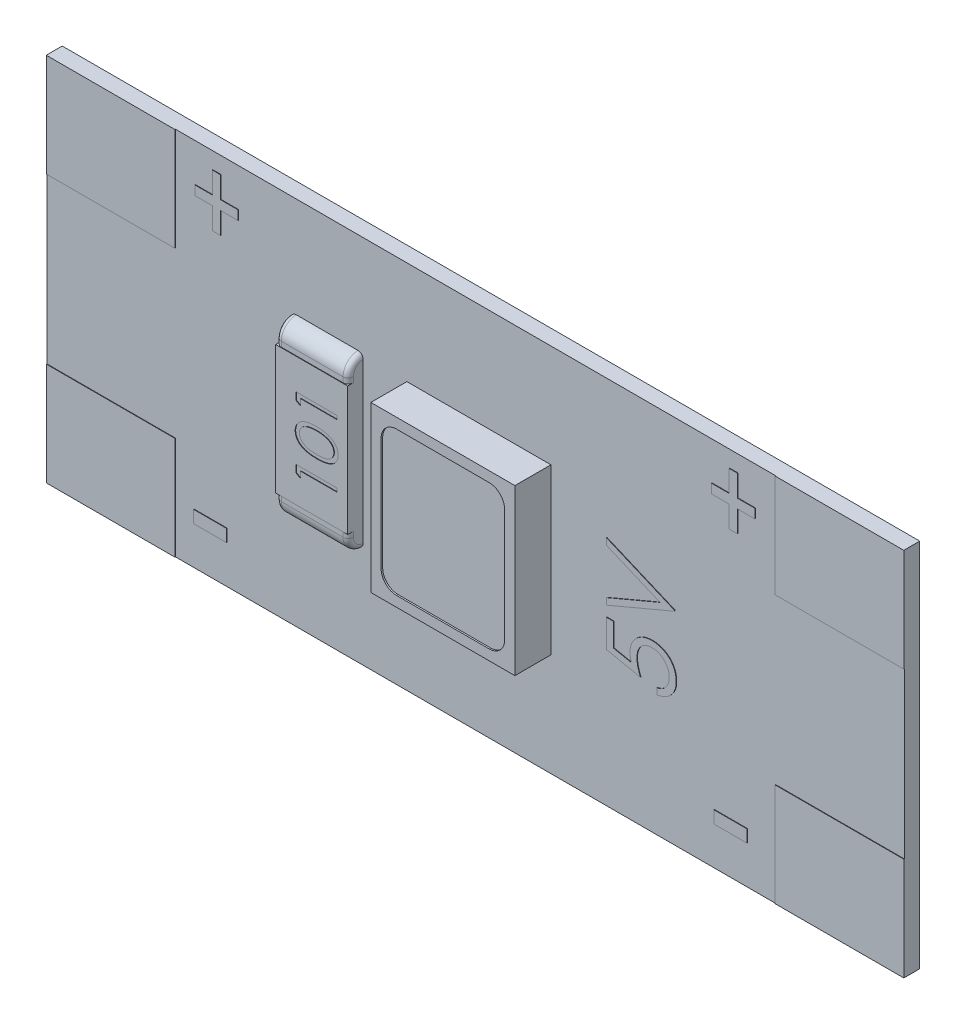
SolidWorks part; units mm, degrees
ref_plane "Front Plane" through (0, 0, 0) normal (0, 0, 1) x (1, 0, 0)
ref_plane "Top Plane" through (0, 0, 0) normal (0, 1, 0) x (1, 0, 0)
ref_plane "Right Plane" through (0, 0, 0) normal (1, 0, 0) x (0, 0, -1)
sketch "Skizze1" plane through (0, 0, 0) normal (0, 0, 1) x (1, 0, 0)
  line L1 (-8.33, 3.6) -> (8.34, 3.6)
  line L2 (-8.33, 3.6) -> (-8.33, -3.6)
  line L3 (-8.33, -3.6) -> (8.34, -3.6)
  line L4 (8.34, 3.6) -> (8.34, -3.6)
  dimension "D1" = 7.2
  dimension "D2" = 16.67
  dimension "D3" = 8.33
  dimension "D4" = 3.6
extrude "Aufsatz-Linear austragen1" add sketch "Skizze1" along normal blind 0.3
sketch "Skizze2" plane through (0, 0, 0.3) normal (0, 0, 1) x (1, 0, 0)
  line L0 (-8.33, 3.6) -> (-8.33, -3.6) construction
  line L1 (-8.33, 3.6) -> (-5.83, 3.6)
  line L2 (-8.33, 3.6) -> (-8.33, 1.6)
  line L3 (-8.33, 1.6) -> (-5.83, 1.6)
  line L4 (-5.83, 3.6) -> (-5.83, 1.6)
  line L5 (8.34, -3.6) -> (8.34, 3.6) construction
  line L6 (-8.33, -1.6) -> (-5.83, -1.6)
  line L7 (-8.33, -1.6) -> (-8.33, -3.6)
  line L8 (-8.33, -3.6) -> (-5.83, -3.6)
  line L9 (-5.83, -1.6) -> (-5.83, -3.6)
  line L10 (8.34, 3.6) -> (5.84, 3.6)
  line L11 (8.34, 3.6) -> (8.34, 1.6)
  line L12 (8.34, 1.6) -> (5.84, 1.6)
  line L13 (5.84, 3.6) -> (5.84, 1.6)
  line L15 (8.34, -1.6) -> (5.84, -1.6)
  line L16 (8.34, -1.6) -> (8.34, -3.6)
  line L17 (8.34, -3.6) -> (5.84, -3.6)
  line L18 (5.84, -1.6) -> (5.84, -3.6)
  point P20 (-8.33, 3.6)
  point P21 (-8.33, -3.6)
  point P22 (8.34, 3.6)
  point P26 (8.34, -3.6)
  point P28 (-7.08, 1.6)
  point P29 (-7.08, -3.6)
  point P30 (5.84, -2.6)
  dimension "D1" = 2
  dimension "D2" = 2
  dimension "D3" = 2
  dimension "D4" = 2
  dimension "D5" = 2.5
  dimension "D6" = 2.5
  dimension "D7" = 2.5
  dimension "D8" = 2.5
extrude "Aufsatz-Linear austragen2" add sketch "Skizze2" along normal blind 0.01
sketch "Skizze3" plane through (0, 0, 0.3) normal (0, 0, 1) x (1, 0, 0)
  line L0 (-8.33, 1.6) -> (-8.33, -1.6) construction
  line L1 (-1.33, 1.6) -> (1.47, 1.6)
  line L2 (-1.33, 1.6) -> (-1.33, -1.6)
  line L3 (-1.33, -1.6) -> (1.47, -1.6)
  line L4 (1.47, 1.6) -> (1.47, -1.6)
  line L5 (5.84, 3.6) -> (-5.83, 3.6) construction
  dimension "D1" = 2.8
  dimension "D2" = 3.2
  dimension "D3" = 7
  dimension "D4" = 2
extrude "Aufsatz-Linear austragen3" add sketch "Skizze3" along normal blind 0.7
sketch "Skizze4" plane through (0, 0, 1) normal (0, 0, 1) x (1, 0, 0)
  line L0 (-1.33, 1.6) -> (-1.33, -1.6) construction
  line L1 (-0.83, 1.4) -> (0.97, 1.4)
  line L2 (-1.13, 1.1) -> (-1.13, -1.1)
  line L3 (-0.83, -1.4) -> (0.97, -1.4)
  line L4 (1.27, 1.1) -> (1.27, -1.1)
  line L5 (1.47, 1.6) -> (-1.33, 1.6) construction
  line L6 (1.47, -1.6) -> (1.47, 1.6) construction
  line L7 (-1.33, -1.6) -> (1.47, -1.6) construction
  arc A0 (0.97, 1.4) -> (1.27, 1.1) centre (0.97, 1.1) cw
  arc A1 (-1.13, -1.1) -> (-0.83, -1.4) centre (-0.83, -1.1) ccw
  arc A2 (0.97, -1.4) -> (1.27, -1.1) centre (0.97, -1.1) ccw
  arc A3 (-0.83, 1.4) -> (-1.13, 1.1) centre (-0.83, 1.1) ccw
  dimension "D5" = 0.3
  dimension "D1" = 0.2
  dimension "D2" = 0.2
  dimension "D3" = 0.2
  dimension "D4" = 0.2
extrude "Schnitt-Linear austragen1" cut sketch "Skizze4" against normal blind 0.03
sketch "Skizze5" plane through (0, 0, 0.3) normal (0, 0, 1) x (1, 0, 0)
  line L0 (-5.543, 2) -> (5.4578, 2) construction
  line L1 (-5.543, -2) -> (5.4578, -2) construction
  line L2 (5.84, 3.6) -> (-5.83, 3.6) construction
  line L3 (-5.83, -3.6) -> (5.84, -3.6) construction
  text T0 "+                  +" font "Arial Narrow" height in points 6
  text T1 "-              -" font "Arial Narrow" height in points 8
  dimension "D1" = 1.6
  dimension "D2" = 1.6
extrude "Aufsatz-Linear austragen4" add sketch "Skizze5" along normal blind 0.01
sketch "Skizze6" plane through (0, 0, 0.3) normal (0, 0, 1) x (1, 0, 0)
  line L1 (-3.5808, 1.25) -> (-2.1808, 1.25)
  line L2 (-3.5808, 1.25) -> (-3.5808, -1.25)
  line L3 (-3.5808, -1.25) -> (-2.1808, -1.25)
  line L4 (-2.1808, 1.25) -> (-2.1808, -1.25)
  point P4 (-2.8808, 1.25)
  dimension "D1" = 1.25
  dimension "D2" = 2.5
  dimension "D3" = 1.4
extrude "Aufsatz-Linear austragen5" add sketch "Skizze6" along normal blind 0.3
sketch "Skizze7" plane through (0, 0, 0.6) normal (0, 0, 1) x (1, 0, 0)
  line L0 (-2.3871, 1.25) -> (-2.3871, -1.25) construction
  line L1 (-2.1808, 1.25) -> (-3.5808, 1.25) construction
  line L2 (-3.5808, -1.25) -> (-2.1808, -1.25) construction
  text T0 "101  " font "Century Gothic" height in points 3
extrude "Schnitt-Linear austragen2" cut sketch "Skizze7" against normal blind 0.01
sketch "Skizze8" plane through (0, 0, 0.3) normal (0, 0, 1) x (1, 0, 0)
  line L1 (-3.5808, 1.25) -> (-2.1808, 1.25)
  line L2 (-3.5808, 1.25) -> (-3.5808, 1.65)
  line L3 (-3.5808, 1.65) -> (-2.1808, 1.65)
  line L4 (-2.1808, 1.25) -> (-2.1808, 1.65)
  line L5 (-3.5808, -1.25) -> (-2.1808, -1.25)
  line L6 (-3.5808, -1.25) -> (-3.5808, -1.65)
  line L7 (-3.5808, -1.65) -> (-2.1808, -1.65)
  line L8 (-2.1808, -1.25) -> (-2.1808, -1.65)
  dimension "D1" = 0.4
  dimension "D2" = 0.4
sketch "Skizze9" plane through (0, 0, 0.3) normal (0, 0, 1) x (1, 0, 0)
  line L1 (-3.5808, 1.25) -> (-2.1808, 1.25)
  line L2 (-3.5808, 1.25) -> (-3.5808, 1.65)
  line L3 (-3.5808, 1.65) -> (-2.1808, 1.65)
  line L4 (-2.1808, 1.25) -> (-2.1808, 1.65)
  line L5 (-3.5808, -1.25) -> (-2.1808, -1.25)
  line L6 (-3.5808, -1.25) -> (-3.5808, -1.65)
  line L7 (-3.5808, -1.65) -> (-2.1808, -1.65)
  line L8 (-2.1808, -1.25) -> (-2.1808, -1.65)
  dimension "D1" = 0.4
  dimension "D2" = 0.4
extrude "Aufsatz-Linear austragen7" add sketch "Skizze9" along normal blind 0.29
fillet "Verrundung1" radius 0.3 2 edges at (-2.8808, -1.65, 0.59) (-2.8808, 1.65, 0.59)
fillet "Verrundung2" radius 0.1 8 edges at (-3.5808, -1.3001, 0.59) (-2.1808, -1.3001, 0.59) (-3.5808, 1.3001, 0.59) (-2.1808, 1.3001, 0.59) (-3.5808, -1.5587, 0.5056) (-2.1808, -1.5587, 0.5056) (-3.5808, 1.5587, 0.5056) (-2.1808, 1.5587, 0.5056)
sketch "Skizze10" plane through (0, 0, 0.3) normal (0, 0, 1) x (1, 0, 0)
  line L0 (3.8821, 1.7699) -> (3.8821, -2.0794) construction
  text T0 "5V" font "Century Gothic" height in points 5
extrude "Aufsatz-Linear austragen8" add sketch "Skizze10" along normal blind 0.01
